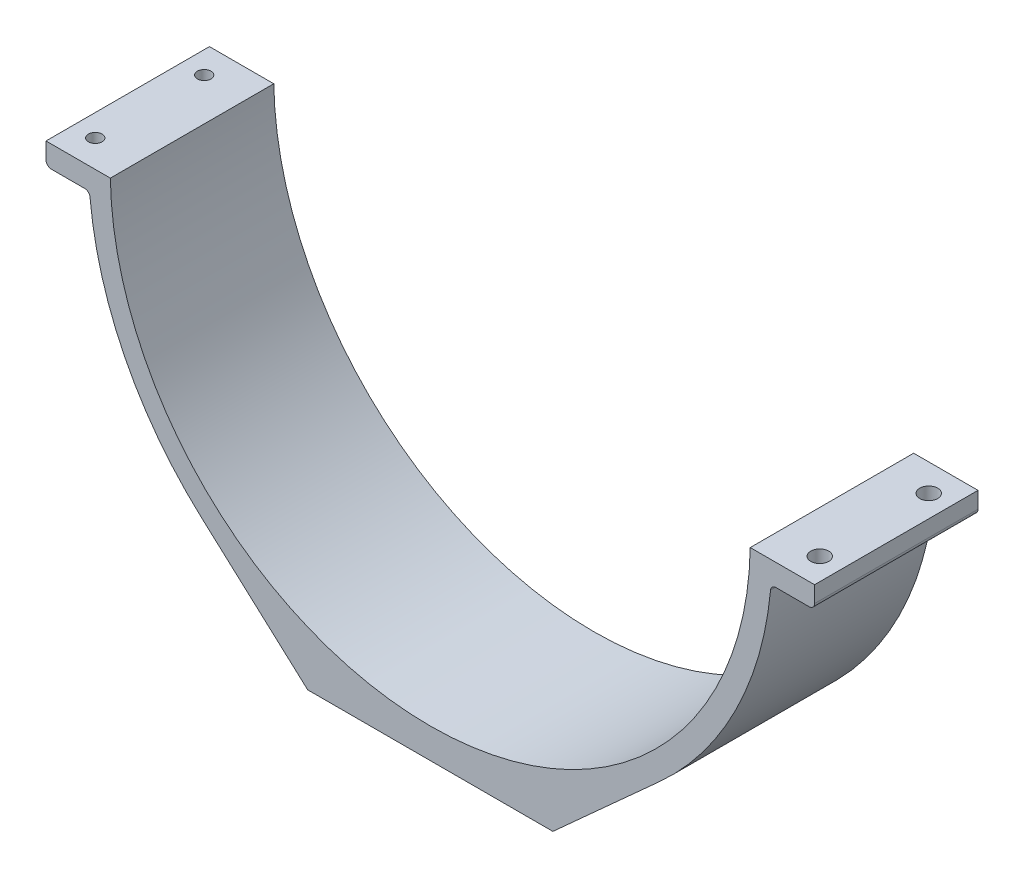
SolidWorks part; units mm, degrees
ref_plane "Front Plane" through (0, 0, 0) normal (0, 0, 1) x (1, 0, 0)
ref_plane "Top Plane" through (0, 0, 0) normal (0, 1, 0) x (1, 0, 0)
ref_plane "Right Plane" through (0, 0, 0) normal (1, 0, 0) x (0, 0, -1)
sketch "Sketch1" plane through (0, 0, 0) normal (0, 0, 1) x (1, 0, 0)
  line L0 (-70.5404, -1) -> (-58.7315, -1)
  line L1 (-44.45, 0) -> (49955.55, 0) construction
  line L2 (-70.5404, -1) -> (-70.5404, -4)
  line L3 (0, 44.45) -> (0, 35.9453) construction
  line L4 (-22.5, -64.24) -> (22.5, -64.24)
  line L5 (-69.5404, -5) -> (-63.457, -5)
  line L6 (-22.5, -64.24) -> (-42.0787, -46.537)
  line L7 (69.5404, -5) -> (63.457, -5)
  line L8 (70.5404, -1) -> (70.5404, -4)
  line L9 (70.5404, -1) -> (58.7315, -1)
  line L10 (22.5, -64.24) -> (42.0787, -46.537)
  circle A0 centre (0, 0) radius 58.74 construction
  arc A1 (-58.7315, -1) -> (58.7315, -1) centre (0, 0) ccw construction
  arc A2 (-62.4614, -5.9059) -> (-42.0787, -46.537) centre (0, 0) ccw
  arc A3 (-70.5404, -4) -> (-69.5404, -5) centre (-69.5404, -4) ccw
  arc A4 (-58.7315, -1) -> (58.7315, -1) centre (0, 0) ccw
  arc A5 (70.5404, -4) -> (69.5404, -5) centre (69.5404, -4) cw
  arc A6 (62.4614, -5.9059) -> (42.0787, -46.537) centre (0, 0) cw
  arc A7 (62.4614, -5.9059) -> (63.457, -5) centre (63.457, -6) cw
  arc A8 (-62.4614, -5.9059) -> (-63.457, -5) centre (-63.457, -6) ccw
  point P23 (-70.5404, -5)
  point P27 (70.5404, -5)
  point P29 (0, -80.9893)
  point P32 (-62.5404, -5)
  point P33 (62.5404, -5)
  point P36 (-62.5404, -5)
  point P37 (0, -58.74)
  dimension "D1" = 22.5
  dimension "D2" = 117.48
  dimension "D6" = 1
  dimension "D7" = 1
  dimension "D11" = 4
  dimension "D3" = 45
  dimension "D12" = 11.809
  dimension "D9" = 1
  dimension "D5" = 4
  dimension "D10" = 4
  dimension "D4" = 5.5
  dimension "D8" = 8
extrude "Boss-Extrude1" add sketch "Sketch1" along normal blind 30
sketch "Sketch6" plane through (0, -5, 0) normal (0, -1, 0) x (1, 0, 0)
  line L0 (-66.4987, 30) -> (-66.4987, 0) construction
  line L2 (-69.5404, 30) -> (-63.457, 30) construction
  line L3 (-69.5404, 0) -> (-63.457, 0) construction
  point P8 (-66.4987, 25)
  point P12 (-66.4987, 5)
  dimension "D3" = 5
  dimension "D4" = 5
sketch "Sketch2" plane through (0, -64.24, 0) normal (0, -1, 0) x (1, 0, 0)
  line L0 (0, 0) -> (0, 50000) construction
  line L1 (-20, 5) -> (49980, 5) construction
  line L2 (-22.5, 30) -> (-22.5, 0) construction
  line L4 (-17.3737, 25) -> (49982.6263, 25) construction
  line L7 (-22.5, 0) -> (22.5, 0) construction
  line L8 (22.5, 30) -> (22.5, 0) construction
  line L9 (-22.5, 30) -> (22.5, 30) construction
  point P2 (-20, 5)
  point P5 (20, 5)
  point P16 (-20, 25)
  point P20 (20, 25)
  dimension "D1" = 2.5
  dimension "D2" = 5
  dimension "D3" = 2.5
  dimension "D4" = 5
hole_wizard "M3x0.5 Tapped Hole1" positions "3DSketch1" profile "Sketch7" tap size "M3x0.5" standard "ANSI Metric"
sketch3d "3DSketch1"
  point P3 (-66.4987, -5, 5)
  point P8 (-66.4987, -5, 25)
sketch "Sketch7" plane through (-66.4987, -5, 5) normal (1, 0, 0) x (0, 0, -1)
  line L0 (0, 0) -> (0, 4)
  line L1 (0, 4) -> (1.25, 4)
  line L2 (1.25, 4) -> (1.25, 0)
  line L5 (1.25, 0) -> (0, 0)
  line L11 (0, -6.35) -> (0, 107.95) construction
  dimension "Thru Tap Drill Dia." = 2.5
  dimension "Thru Tap Drill Depth" = 4
hole_wizard "M4x0.7 Tapped Hole1" positions "3DSketch2" profile "Sketch8" tap size "M4x0.7" standard "ANSI Metric"
sketch3d "3DSketch2"
  point P0 (-20, -64.24, 5)
  point P3 (20, -64.24, 5)
  point P6 (-20, -64.24, 25)
  point P9 (20, -64.24, 25)
sketch "Sketch8" plane through (-20, -64.24, 5) normal (1, 0, 0) x (0, 0, -1)
  line L0 (0, 0) -> (0, 8.4914)
  line L1 (0, 8.4914) -> (1.65, 7.5)
  line L2 (1.65, 7.5) -> (1.65, 0)
  line L5 (1.65, 0) -> (0, 0)
  line L10 (0, 8.4914) -> (-1.65, 7.5) construction
  line L11 (0, -6.35) -> (0, 107.95) construction
  dimension "Tap Drill Dia." = 3.3
  dimension "Tap Drill Depth" = 7.5
  dimension "Drill Angle" = 118
sketch "Sketch9" plane through (0, -5, 0) normal (0, -1, 0) x (1, 0, 0)
  line L0 (66.4987, 30) -> (66.4987, 0) construction
  line L1 (63.457, 30) -> (69.5404, 30) construction
  line L2 (63.457, 0) -> (69.5404, 0) construction
  line L3 (-200017.3737, 25) -> (249982.6263, 25) construction
  line L4 (-200020, 5) -> (249980, 5) construction
  circle A0 centre (66.4987, 25) radius 1.65
  circle A1 centre (66.4987, 5) radius 1.65
  dimension "D1" = 3.3
extrude "Cut-Extrude1" cut sketch "Sketch9" against normal through all
